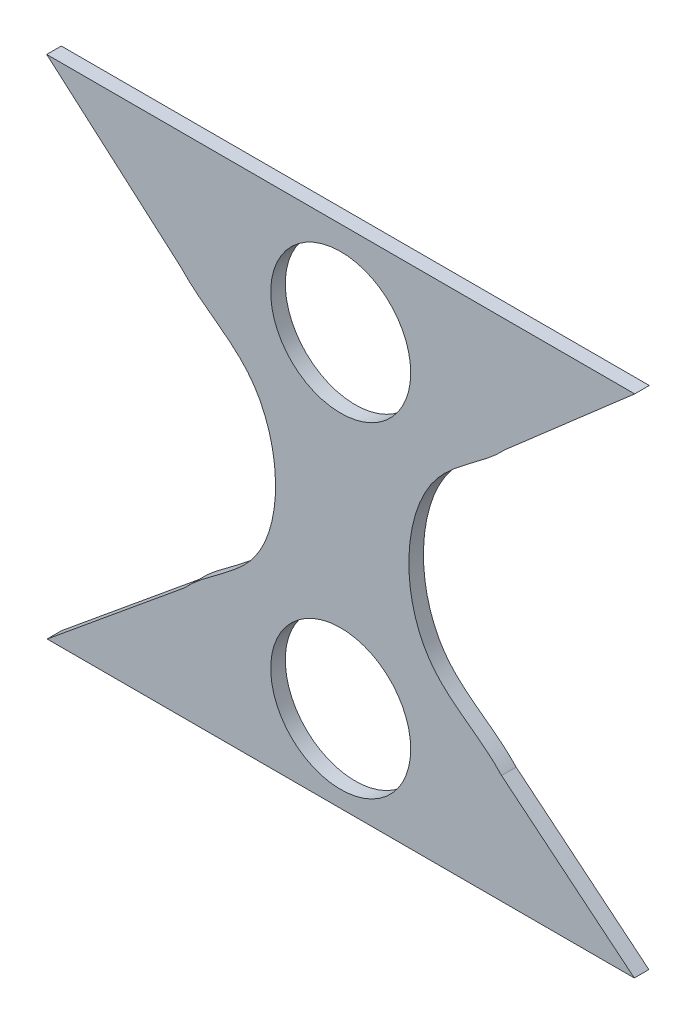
SolidWorks part; units mm, degrees
ref_plane "Front Plane" through (0, 0, 0) normal (0, 0, 1) x (1, 0, 0)
ref_plane "Top Plane" through (0, 0, 0) normal (0, 1, 0) x (1, 0, 0)
ref_plane "Right Plane" through (0, 0, 0) normal (1, 0, 0) x (0, 0, -1)
sketch "Sketch1" plane through (0, 0, 0) normal (0, 0, 1) x (1, 0, 0)
  line L0 (252, -214.0454) -> (264.5, -213.75) construction
  line L1 (-136.9853, 119.5903) -> (-252, 220)
  line L2 (-252, -214.0454) -> (-252, 220)
  line L3 (-252, 220) -> (252, 220)
  line L4 (252, -214.0454) -> (252, 220)
  line L5 (-245.359, -214.2023) -> (252, 220) construction
  line L6 (-252, 220) -> (244.8409, -213.75) construction
  line L7 (-264.5, -226.25) -> (264.5, -226.25)
  line L8 (-264.5, -226.25) -> (-264.5, -213.75)
  line L9 (-264.5, -213.75) -> (264.5, -213.75)
  line L10 (264.5, -226.25) -> (264.5, -213.75)
  line L11 (140.7934, 122.9148) -> (252, 220)
  line L12 (-264.5, -213.75) -> (-245.359, -214.2023) construction
  line L13 (252, -214.0454) -> (137.8816, -120.3729)
  line L14 (-252, -214.0454) -> (-134.1523, -117.1171)
  line L15 (-264.5, 0) -> (297.6298, 0) construction
  circle A0 centre (0, 139.6504) radius 60
  circle A1 centre (0, -139.6504) radius 60
  spline S0 degree 3 poles (-136.9853, 119.5903) (-119.179, 100.2537) (-51.3114, 69.2589) (-46.8569, -66.796) (-116.61, -97.7907) (-134.1523, -117.1171) knots 0 0 0 0 0.270924 0.729213 1 1 1 1
  spline S1 degree 3 poles (140.7934, 122.9148) (122.9187, 103.6473) (53.5527, 71.2374) (48.9581, -68.6851) (120.2462, -101.0952) (137.8816, -120.3729) knots 0 0 0 0 0.264791 0.735076 1 1 1 1
  point P0 (0, 0)
  point P6 (0, -220)
  dimension "D1" = 120
  dimension "D2" = 504
  dimension "D3" = 12.5
  dimension "D4" = 529
extrude "Boss-Extrude1" add sketch "Sketch1" against normal blind 12.5 contours S1 L11 L3 L1 S0 L14 L9 L13 A0 A1
